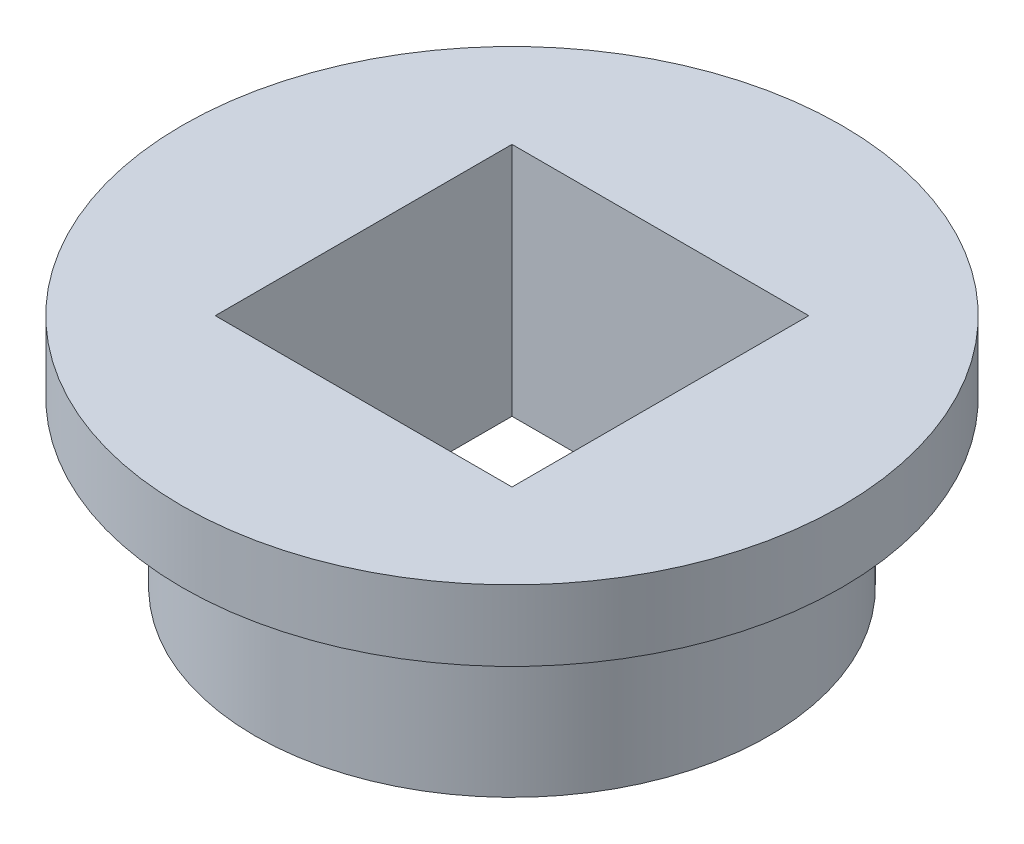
SolidWorks part; units mm, degrees
ref_plane "Front Plane" through (0, 0, 0) normal (0, 0, 1) x (1, 0, 0)
ref_plane "Top Plane" through (0, 0, 0) normal (0, 1, 0) x (1, 0, 0)
ref_plane "Right Plane" through (0, 0, 0) normal (1, 0, 0) x (0, 0, -1)
sketch "Sketch1" plane through (0, 0, 0) normal (0, 1, 0) x (1, 0, 0)
  line L0 (0, 6.3) -> (12.6, 6.3) construction
  line L1 (0, 0) -> (12.6, 0)
  line L2 (0, 0) -> (0, 12.6)
  line L3 (0, 12.6) -> (12.6, 12.6)
  line L4 (12.6, 0) -> (12.6, 12.6)
  circle A0 centre (6.3, 6.3) radius 10.91
  dimension "D2" = 21.82
  dimension "D1" = 12.6
  dimension "D3" = 17.8191
extrude "Boss-Extrude1" add sketch "Sketch1" along normal blind 7
sketch "Sketch2" plane through (0, 7, 0) normal (0, 1, 0) x (1, 0, 0)
  circle A0 centre (6.3, 6.3) radius 14
  circle A1 centre (6.3, 6.3) radius 10.91
  circle A2 centre (6.3, 6.3) radius 10.91
  dimension "D2" = 28
  dimension "D1" = 0
extrude "Boss-Extrude2" add sketch "Sketch2" along normal blind 3 contours M2 M6 M3 M4 M5 | A0 M2
